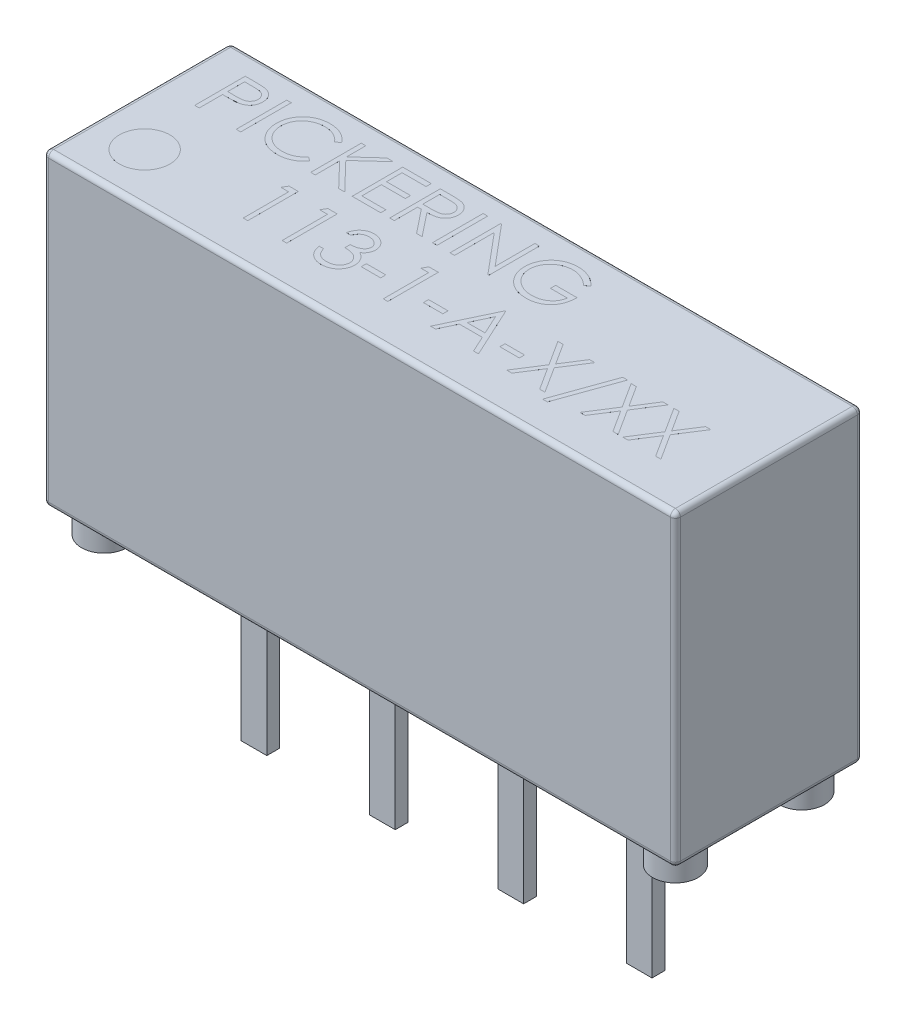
SolidWorks part; units mm, degrees
ref_plane "Front Plane" through (0, 0, 0) normal (0, 0, 1) x (1, 0, 0)
ref_plane "Top Plane" through (0, 0, 0) normal (0, 1, 0) x (1, 0, 0)
ref_plane "Right Plane" through (0, 0, 0) normal (1, 0, 0) x (0, 0, -1)
sketch "Sketch1" plane through (0, 0, 0) normal (0, 1, 0) x (1, 0, 0)
  line L1 (6.25, -1.85) -> (-6.25, -1.85)
  line L2 (6.25, -1.85) -> (6.25, 1.85)
  line L3 (6.25, 1.85) -> (-6.25, 1.85)
  line L4 (-6.25, -1.85) -> (-6.25, 1.85)
  line L5 (6.25, -1.85) -> (-6.25, 1.85) construction
  line L6 (6.25, 1.85) -> (-6.25, -1.85) construction
  point P0 (0, 0)
  dimension "D1" = 12.5
  dimension "D2" = 3.7
extrude "Main Body" add sketch "Sketch1" along normal blind 6.092
sketch "Sketch2" plane through (0, 0, 0) normal (0, -1, 0) x (1, 0, 0)
  line L0 (-6.25, 1.85) -> (6.25, 1.85) construction
  line L1 (-6.25, -1.85) -> (-6.25, 1.85) construction
  line L2 (6.25, -1.85) -> (-6.25, -1.85) construction
  line L3 (6.25, 1.85) -> (6.25, -1.85) construction
  circle A0 centre (-5.65, 1.25) radius 0.45
  circle A1 centre (-5.65, -1.25) radius 0.45
  circle A2 centre (5.65, -1.25) radius 0.45
  circle A3 centre (5.65, 1.25) radius 0.45
  dimension "D1" = 0.9
  dimension "D4" = 0.9
  dimension "D6" = 0.9
  dimension "D8" = 0.9
  dimension "D2" = 0.6
  dimension "D3" = 0.6
  dimension "D5" = 0.6
  dimension "D7" = 0.6
extrude "Feet" add sketch "Sketch2" along normal blind 0.508
sketch "Sketch3" plane through (0, 0, 0) normal (0, -1, 0) x (1, 0, 0)
  line L0 (6.25, 1.85) -> (6.25, -1.85) construction
  line L1 (-3.556, -0.127) -> (-4.064, -0.127)
  line L2 (-3.556, -0.127) -> (-3.556, 0.127)
  line L3 (-3.556, 0.127) -> (-4.064, 0.127)
  line L4 (-4.064, -0.127) -> (-4.064, 0.127)
  line L5 (-3.556, -0.127) -> (-4.064, 0.127) construction
  line L6 (-3.556, 0.127) -> (-4.064, -0.127) construction
  line L7 (-1.016, -0.127) -> (-1.524, -0.127)
  line L8 (-1.016, -0.127) -> (-1.016, 0.127)
  line L9 (-1.016, 0.127) -> (-1.524, 0.127)
  line L10 (-1.524, -0.127) -> (-1.524, 0.127)
  line L11 (-1.016, -0.127) -> (-1.524, 0.127) construction
  line L12 (-1.016, 0.127) -> (-1.524, -0.127) construction
  line L13 (1.524, -0.127) -> (1.016, -0.127)
  line L14 (1.524, -0.127) -> (1.524, 0.127)
  line L15 (1.524, 0.127) -> (1.016, 0.127)
  line L16 (1.016, -0.127) -> (1.016, 0.127)
  line L17 (1.524, -0.127) -> (1.016, 0.127) construction
  line L18 (1.524, 0.127) -> (1.016, -0.127) construction
  line L19 (3.556, -0.127) -> (4.064, -0.127)
  line L20 (3.556, -0.127) -> (3.556, 0.127)
  line L21 (3.556, 0.127) -> (4.064, 0.127)
  line L22 (4.064, -0.127) -> (4.064, 0.127)
  line L23 (3.556, -0.127) -> (4.064, 0.127) construction
  line L24 (3.556, 0.127) -> (4.064, -0.127) construction
  point P0 (-3.81, 0)
  point P5 (-1.27, 0)
  point P10 (1.27, 0)
  point P15 (3.81, 0)
  dimension "D1" = 0.508
  dimension "D2" = 0.254
  dimension "D3" = 0.508
  dimension "D4" = 0.254
  dimension "D5" = 0.508
  dimension "D6" = 0.254
  dimension "D7" = 0.508
  dimension "D8" = 0.254
  dimension "D9" = 2.54
  dimension "D10" = 2.54
  dimension "D11" = 2.54
  dimension "D12" = 2.44
extrude "Pins" add sketch "Sketch3" along normal blind 3.808
sketch "Sketch4"
  dimension "D3" = 1
  dimension "D1" = 1.45
  dimension "D2" = 1.45
  dimension "D4" = 1
  dimension "D5" = 1
extrude "Lettering" add sketch "Sketch4" along normal blind 0.0001
fillet "Fillet1" radius 0.1 12 edges at (6.25, 6.092, 0) (6.25, 0, 0) (6.25, 3.046, -1.85) (0, 6.092, -1.85) (0, 0, -1.85) (-6.25, 3.046, -1.85) (-6.25, 6.092, 0) (-6.25, 0, 0) (-6.25, 3.046, 1.85) (0, 6.092, 1.85) (6.25, 3.046, 1.85) (0, 0, 1.85)
